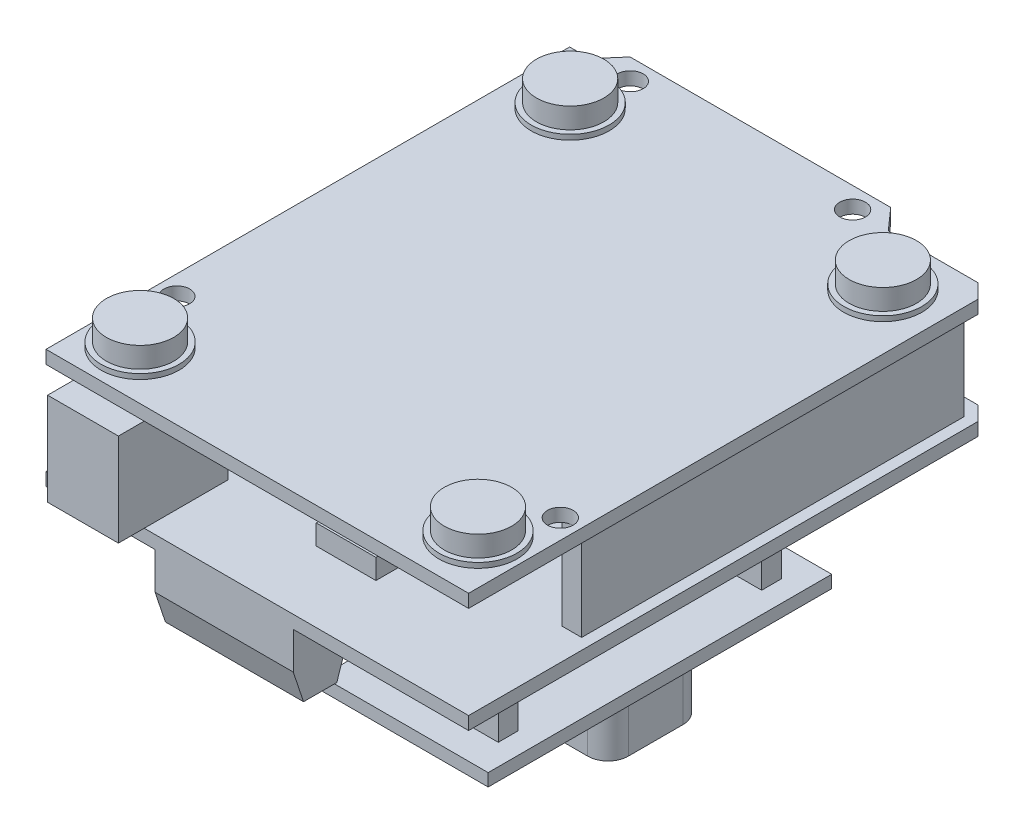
SolidWorks part; units mm, degrees
ref_plane "Front Plane" through (0, 0, 0) normal (0, 0, 1) x (1, 0, 0)
ref_plane "Top Plane" through (0, 0, 0) normal (0, 1, 0) x (1, 0, 0)
ref_plane "Right Plane" through (0, 0, 0) normal (1, 0, 0) x (0, 0, -1)
sketch "Sketch1" plane through (0, 0, 0) normal (0, 1, 0) x (1, 0, 0)
  line L0 (0, 65.9511) -> (2.54, 65.9511)
  line L1 (0, 0) -> (53.2257, 0)
  line L2 (0, 0) -> (0, 65.9511)
  line L3 (2.54, 65.9511) -> (4.8918, 68.6689)
  line L4 (53.2257, 0) -> (53.2257, 64.155)
  line L5 (4.8918, 68.6689) -> (37.7213, 68.6689)
  line L6 (37.7213, 68.6689) -> (40.131, 65.9511)
  line L7 (40.131, 65.9511) -> (51.4296, 65.9511)
  line L8 (0.8445, 14.0144) -> (0, 14.0144) construction
  line L9 (52.3811, 14.0144) -> (53.2257, 14.0144) construction
  line L10 (2.4638, 12.3952) -> (2.4638, 0) construction
  line L11 (35.5536, 67.6529) -> (35.5536, 68.6689) construction
  line L12 (51.4296, 65.9511) -> (53.2257, 64.155)
  line L13 (53.2257, 64.155) -> (53.2257, 65.9511) construction
  line L14 (53.2257, 65.9511) -> (51.4296, 65.9511) construction
  circle A0 centre (7.5629, 66.0336) radius 1.6192
  circle A1 centre (35.5536, 66.0336) radius 1.6193
  circle A2 centre (2.4638, 14.0144) radius 1.6192
  circle A3 centre (50.7619, 14.0144) radius 1.6193
  point P17 (49.1426, 14.0144)
  point P18 (4.083, 14.0144)
  point P28 (5.9436, 66.0336)
  point P30 (37.1729, 66.0336)
  dimension "D6" = 3.2385
  dimension "D1" = 65.9511
  dimension "D2" = 53.2257
  dimension "D3" = 32.8295
  dimension "D4" = 68.6689
  dimension "D5" = 45.0596
  dimension "D7" = 12.3952
  dimension "D8" = 1.016
  dimension "D9" = 5.9436
  dimension "D10" = 3.5941
  dimension "D11" = 2.54
  dimension "D12" = 3.6322
  dimension "D13" = 16.0528
  dimension "D14" = 2.54
extrude "Boss-Extrude1" add sketch "Sketch1" against normal blind 1.651
sketch "Sketch2" plane through (0, 0, 0) normal (0, 1, 0) x (1, 0, 0)
  line L0 (53.2257, 0) -> (53.2257, 64.155) construction
  line L1 (51.4296, 65.9511) -> (40.131, 65.9511) construction
  line L2 (37.7213, 68.6689) -> (4.8918, 68.6689) construction
  line L3 (0, 65.9511) -> (0, 0) construction
  line L4 (0, 0) -> (53.2257, 0) construction
  circle A0 centre (46.2153, 59.182) radius 4.9149
  circle A1 centre (6.731, 59.2836) radius 4.9149
  circle A2 centre (5.7531, 6.096) radius 4.9149
  circle A3 centre (47.625, 6.7818) radius 4.9149
  point P9 (51.1302, 59.182)
  point P11 (52.5399, 6.7818)
  point P13 (46.2153, 64.0969)
  point P15 (6.731, 64.1985)
  point P18 (1.8161, 59.2836)
  point P21 (5.7531, 1.1811)
  point P22 (0.8382, 6.096)
  point P25 (47.625, 1.8669)
  dimension "D1" = 9.8298
  dimension "D2" = 2.0955
  dimension "D3" = 0.6858
  dimension "D4" = 1.8542
  dimension "D5" = 4.4704
  dimension "D6" = 1.8161
  dimension "D7" = 0.8382
  dimension "D8" = 1.1811
  dimension "D9" = 1.8669
extrude "Boss-Extrude2" add sketch "Sketch2" along normal blind 0.6477
sketch "Sketch4" plane through (0, 0, 0) normal (0, 1, 0) x (1, 0, 0)
  circle A0 centre (47.625, 6.7818) radius 4.9149 construction
  circle A1 centre (5.7531, 6.096) radius 4.9149 construction
  circle A2 centre (46.2153, 59.182) radius 4.9149 construction
  circle A3 centre (6.731, 59.2836) radius 4.9149 construction
  circle A4 centre (47.625, 6.7818) radius 4.9149 construction
  circle A5 centre (5.7531, 6.096) radius 4.9149 construction
  circle A6 centre (46.2153, 59.182) radius 4.9149 construction
  circle A7 centre (6.731, 59.2836) radius 4.9149 construction
  circle A8 centre (47.625, 6.7818) radius 4.2418
  circle A9 centre (5.7531, 6.096) radius 4.2418
  circle A10 centre (46.2153, 59.182) radius 4.2418
  circle A11 centre (6.731, 59.2836) radius 4.2418
  dimension "D1" = 8.4836
extrude "Boss-Extrude3" add sketch "Sketch4" along normal blind 3.2512
sketch "Sketch6" plane through (0, -1.651, 0) normal (0, -1, 0) x (1, 0, 0)
  line L0 (53.2257, 0) -> (53.2257, -64.155) construction
  line L1 (51.8287, -15.6337) -> (49.3649, -15.6337)
  line L2 (51.8287, -15.6337) -> (51.8287, -63.7794)
  line L3 (51.8287, -63.7794) -> (49.3649, -63.7794)
  line L4 (49.3649, -15.6337) -> (49.3649, -63.7794)
  line L5 (3.8608, -24.9301) -> (1.397, -24.9301)
  line L6 (3.8608, -24.9301) -> (3.8608, -63.7794)
  line L7 (3.8608, -63.7794) -> (1.397, -63.7794)
  line L8 (1.397, -24.9301) -> (1.397, -63.7794)
  line L9 (51.8287, -39.7066) -> (53.2257, -39.7066) construction
  line L10 (1.397, -44.3547) -> (0, -44.3547) construction
  line L11 (0, -65.9511) -> (0, 0) construction
  circle A0 centre (50.7619, -14.0144) radius 1.6193 construction
  dimension "D1" = 2.4638
  dimension "D2" = 38.8493
  dimension "D3" = 48.1457
  dimension "D4" = 1.397
extrude "Boss-Extrude4" add sketch "Sketch6" along normal blind 11.684
sketch "Sketch7" plane through (0, -13.335, 0) normal (0, -1, 0) x (1, 0, 0)
  line L0 (0, 0) -> (53.2257, 0) construction
  line L1 (0, -65.9511) -> (0, 0) construction
  line L2 (2.54, -65.9511) -> (0, -65.9511) construction
  line L3 (4.8918, -68.6689) -> (2.54, -65.9511) construction
  line L4 (37.7213, -68.6689) -> (4.8918, -68.6689) construction
  line L5 (40.131, -65.9511) -> (37.7213, -68.6689) construction
  line L6 (51.4296, -65.9511) -> (40.131, -65.9511) construction
  line L7 (53.2257, -64.155) -> (51.4296, -65.9511) construction
  line L8 (53.2257, 0) -> (53.2257, -64.155) construction
  line L9 (0, 0) -> (53.2257, 0)
  line L10 (0, -65.9511) -> (0, 0)
  line L11 (2.54, -65.9511) -> (0, -65.9511)
  line L12 (4.8918, -68.6689) -> (2.54, -65.9511)
  line L13 (37.7213, -68.6689) -> (4.8918, -68.6689)
  line L14 (40.131, -65.9511) -> (37.7213, -68.6689)
  line L15 (51.4296, -65.9511) -> (40.131, -65.9511)
  line L16 (53.2257, -64.155) -> (51.4296, -65.9511)
  line L17 (53.2257, 0) -> (53.2257, -64.155)
extrude "Boss-Extrude5" add sketch "Sketch7" along normal blind 1.6383
sketch "Sketch8" plane through (0, 0, 0) normal (0, 0, 1) x (1, 0, 0)
  line L0 (0, -1.651) -> (53.2257, -1.651) construction
  line L1 (41.8211, -1.651) -> (34.3027, -1.651)
  line L2 (41.8211, -1.651) -> (41.8211, -4.1783)
  line L3 (41.8211, -4.1783) -> (34.3027, -4.1783)
  line L4 (34.3027, -1.651) -> (34.3027, -4.1783)
  line L5 (0, 0) -> (53.2257, 0) construction
  line L6 (53.2257, -1.651) -> (53.2257, 0) construction
  dimension "D1" = 7.5184
  dimension "D2" = 4.1783
  dimension "D3" = 11.4046
extrude "Boss-Extrude6" add sketch "Sketch8" along normal blind 0.2667 and the other way blind 5.08
sketch "Sketch9" plane through (0, 0, 0) normal (0, 0, 1) x (1, 0, 0)
  line L0 (0, -1.651) -> (34.3027, -1.651) construction
  line L1 (12.3698, -1.651) -> (3.4544, -1.651)
  line L2 (12.3698, -1.651) -> (12.3698, -13.335)
  line L3 (12.3698, -13.335) -> (3.4544, -13.335)
  line L4 (3.4544, -1.651) -> (3.4544, -13.335)
  line L5 (53.2257, -13.335) -> (0, -13.335) construction
  line L6 (0, -1.651) -> (0, 0) construction
  dimension "D1" = 8.9154
  dimension "D2" = 3.4544
extrude "Boss-Extrude7" add sketch "Sketch9" along normal blind 3.2512 and the other way blind 10.541
sketch "Sketch10" plane through (0, -14.9733, 0) normal (0, -1, 0) x (1, 0, 0)
  line L0 (0, 0) -> (0, -65.9511) construction
  line L1 (13.7414, 0) -> (31.1404, 0)
  line L2 (13.7414, 0) -> (13.7414, -6.7818)
  line L3 (13.7414, -6.7818) -> (31.1404, -6.7818)
  line L4 (31.1404, 0) -> (31.1404, -6.7818)
  line L5 (0, -16.8275) -> (6.7818, -16.8275)
  line L6 (0, -16.8275) -> (0, -23.876)
  line L7 (0, -23.876) -> (6.7818, -23.876)
  line L8 (6.7818, -16.8275) -> (6.7818, -23.876)
  line L9 (5.4102, -61.8871) -> (22.8092, -61.8871)
  line L10 (5.4102, -61.8871) -> (5.4102, -68.6689)
  line L11 (5.4102, -68.6689) -> (22.8092, -68.6689)
  line L12 (22.8092, -61.8871) -> (22.8092, -68.6689)
  line L13 (4.8918, -68.6689) -> (37.7213, -68.6689) construction
  line L14 (53.2257, 0) -> (0, 0) construction
  dimension "D1" = 6.7818
  dimension "D2" = 17.399
  dimension "D3" = 7.0485
  dimension "D4" = 5.4102
  dimension "D5" = 13.7414
  dimension "D6" = 16.8275
extrude "Boss-Extrude8" add sketch "Sketch10" along normal blind 8.5471
chamfer "Chamfer1" distance 3.8862 distance2 1.2954 6 edges at (14.1097, -23.5204, -61.8871) (14.1097, -23.5204, -68.6689) (6.7818, -23.5204, -20.3518) (0, -23.5204, -20.3518) (22.4409, -23.5204, -6.7818) (22.4409, -23.5204, 0)
sketch "Sketch12" plane through (0, -14.9733, 0) normal (0, -1, 0) x (1, 0, 0)
  line L1 (30.5943, -56.9468) -> (45.9613, -56.9468)
  line L2 (30.5943, -56.9468) -> (30.5943, -65.9511)
  line L3 (30.5943, -65.9511) -> (45.9613, -65.9511)
  line L4 (45.9613, -56.9468) -> (45.9613, -65.9511)
  line L6 (40.131, -65.9511) -> (51.4296, -65.9511) construction
  line L7 (53.2257, -64.155) -> (53.2257, 0) construction
  dimension "D1" = 9.0043
  dimension "D2" = 15.367
  dimension "D3" = 7.2644
extrude "Boss-Extrude9" add sketch "Sketch12" along normal offset from surface (4.6101 mm away) 6.2484
sketch "Sketch13" plane through (0, -19.5834, 0) normal (0, -1, 0) x (1, 0, 0)
  line L0 (41.8211, -5.08) -> (41.8211, 0.2667) construction
  line L1 (34.3027, -5.08) -> (41.8211, -5.08) construction
  line L2 (41.8211, -5.08) -> (41.8211, 0.2667) construction
  line L3 (34.3027, -5.08) -> (41.8211, -5.08) construction
  line L4 (34.3027, -5.08) -> (41.8211, -5.08) construction
  line L5 (41.8211, -5.08) -> (41.8211, 0.2667) construction
  line L6 (30.5943, -61.849) -> (34.5186, -61.849) construction
  line L7 (42.037, -61.849) -> (34.5186, -61.849)
  line L8 (42.037, -61.849) -> (42.037, -67.1957)
  line L9 (42.037, -67.1957) -> (34.5186, -67.1957)
  line L10 (34.5186, -61.849) -> (34.5186, -67.1957)
  line L11 (30.5943, -56.9468) -> (30.5943, -65.9511) construction
  line L12 (42.037, -61.849) -> (45.9613, -61.849) construction
  line L13 (45.9613, -65.9511) -> (45.9613, -56.9468) construction
  line L14 (30.5943, -65.9511) -> (45.9613, -65.9511) construction
  dimension "D1" = 1.2446
extrude "Boss-Extrude10" add sketch "Sketch13" along normal blind 2.667
sketch "Sketch14" plane through (0, -14.9733, 0) normal (0, -1, 0) x (1, 0, 0)
  line L0 (1.2954, -23.876) -> (5.4864, -23.876) construction
  line L1 (8.6868, -18.6944) -> (11.2268, -18.6944)
  line L2 (8.6868, -18.6944) -> (8.6868, -23.876)
  line L3 (8.6868, -23.876) -> (11.2268, -23.876)
  line L4 (11.2268, -18.6944) -> (11.2268, -23.876)
  line L6 (0, -23.876) -> (0, -65.9511) construction
  dimension "D1" = 2.54
  dimension "D2" = 5.1816
  dimension "D3" = 11.2268
extrude "Boss-Extrude11" add sketch "Sketch14" along normal blind 16.1544
sketch "Sketch15" plane through (0, -14.9733, 0) normal (0, -1, 0) x (1, 0, 0)
  line L0 (53.2257, -64.155) -> (53.2257, 0) construction
  line L1 (28.0543, -13.7922) -> (43.1673, -13.7922)
  line L2 (28.0543, -13.7922) -> (28.0543, -16.2814)
  line L3 (28.0543, -16.2814) -> (43.1673, -16.2814)
  line L4 (43.1673, -13.7922) -> (43.1673, -16.2814)
  line L5 (28.0543, -46.9646) -> (43.1673, -46.9646)
  line L6 (28.0543, -46.9646) -> (28.0543, -49.4538)
  line L7 (28.0543, -49.4538) -> (43.1673, -49.4538)
  line L8 (43.1673, -46.9646) -> (43.1673, -49.4538)
  line L9 (53.2257, 0) -> (31.1404, 0) construction
  point P8 (34.7331, -10.3902)
  point P9 (0, 0)
  dimension "D1" = 15.113
  dimension "D2" = 2.4892
  dimension "D3" = 30.6832
  dimension "D4" = 10.0584
  dimension "D5" = 13.7922
extrude "Boss-Extrude12" add sketch "Sketch15" along normal blind 13.208
sketch "Sketch16" plane through (0, -28.1813, 0) normal (0, -1, 0) x (1, 0, 0)
  line L0 (43.1673, -13.7922) -> (45.8343, -13.7922) construction
  line L1 (24.8285, -9.8552) -> (45.8343, -9.8552)
  line L2 (24.8285, -9.8552) -> (24.8285, -53.1241)
  line L3 (24.8285, -53.1241) -> (45.8343, -53.1241)
  line L4 (45.8343, -9.8552) -> (45.8343, -53.1241)
  line L5 (43.1673, -13.7922) -> (43.1673, -9.8552) construction
  point P11 (43.1673, -53.1241)
  dimension "D1" = 43.2689
  dimension "D2" = 21.0058
  dimension "D3" = 3.937
  dimension "D4" = 2.667
extrude "Boss-Extrude13" add sketch "Sketch16" along normal blind 1.5748
sketch "Sketch17" plane through (0, -29.7561, 0) normal (0, -1, 0) x (1, 0, 0)
  line L0 (42.7449, -37.4967) -> (35.8427, -37.4967)
  line L1 (33.2867, -34.9407) -> (33.2867, -28.0386)
  line L2 (35.8427, -25.4825) -> (42.7449, -25.4825)
  line L3 (45.3009, -28.0386) -> (45.3009, -34.9407)
  line L4 (45.8343, -53.1241) -> (45.8343, -9.8552) construction
  line L5 (33.2867, -31.4896) -> (45.8343, -31.4897) construction
  line L6 (30.1879, -9.8552) -> (30.1879, -23.1902) construction
  line L7 (45.8343, -9.8552) -> (24.8285, -9.8552) construction
  line L8 (33.4137, -19.9644) -> (24.8285, -19.9644) construction
  line L9 (24.8285, -9.8552) -> (24.8285, -53.1241) construction
  arc A0 (35.8427, -37.4967) -> (33.2867, -34.9407) centre (35.8427, -34.9407) cw
  arc A1 (33.2867, -28.0386) -> (35.8427, -25.4825) centre (35.8427, -28.0386) cw
  arc A2 (42.7449, -25.4825) -> (45.3009, -28.0386) centre (42.7449, -28.0386) cw
  arc A3 (45.3009, -34.9407) -> (42.7449, -37.4967) centre (42.7449, -34.9407) cw
  circle A4 centre (30.1879, -19.9644) radius 3.2258
  dimension "D4" = 6.4516
  dimension "D1" = 12.0142
  dimension "D2" = 0.5334
  dimension "D3" = 13.335
  dimension "D5" = 8.5852
extrude "Boss-Extrude14" add sketch "Sketch17" along normal blind 5.9944
sketch "Sketch18" plane through (0, -29.7561, 0) normal (0, -1, 0) x (1, 0, 0)
  line L0 (30.1879, -43.1292) -> (30.1879, -23.1902) construction
  line L1 (30.1879, -39.9034) -> (30.1879, -53.1241) construction
  line L2 (24.8285, -53.1241) -> (45.8343, -53.1241) construction
  circle A0 centre (30.1879, -43.1292) radius 3.2258
  circle A1 centre (30.1879, -19.9644) radius 3.2258 construction
  circle A2 centre (30.1879, -19.9644) radius 3.2258 construction
  dimension "D1" = 13.2207
extrude "Boss-Extrude15" add sketch "Sketch18" along normal blind 7.9629
ref_plane "Plane1" through (26.6128, 0, 0) normal (1, 0, 0) x (0, 0, -1)
ref_plane "Plane2" through (0, 0, -34.3345) normal (0, 0, 1) x (1, 0, 0)
